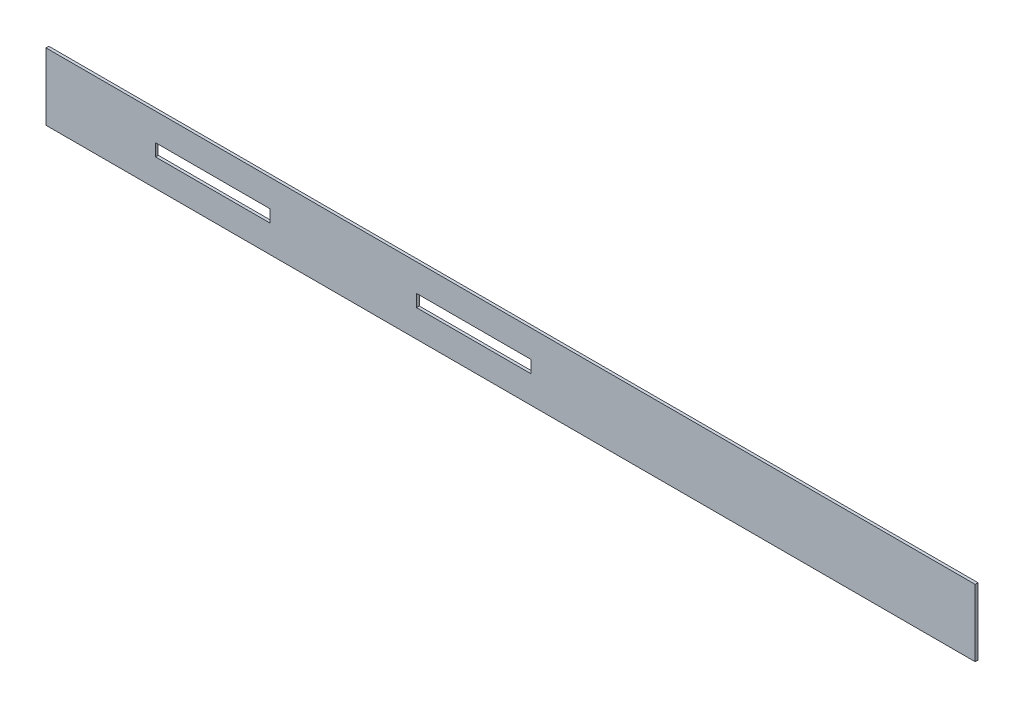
SolidWorks part; units mm, degrees
ref_plane "Plan de face" through (0, 0, 0) normal (0, 0, 1) x (1, 0, 0)
ref_plane "Plan de dessus" through (0, 0, 0) normal (0, 1, 0) x (1, 0, 0)
ref_plane "Plan de droite" through (0, 0, 0) normal (1, 0, 0) x (0, 0, -1)
sketch "Esquisse1" plane through (0, 0, 0) normal (0, 0, 1) x (1, 0, 0)
  line L1 (-1417.1046, 404.5346) -> (1215.8954, 404.5346)
  line L2 (-1417.1046, 404.5346) -> (-1417.1046, 214.5346)
  line L3 (-1417.1046, 214.5346) -> (1215.8954, 214.5346)
  line L4 (1215.8954, 404.5346) -> (1215.8954, 214.5346)
  line L10 (-1417.1046, 209.5346) -> (-1417.1046, 264.5346) construction
  line L11 (1215.8954, 209.5346) -> (-1417.1046, 209.5346) construction
  line L12 (1215.8954, 409.5346) -> (-1417.1046, 409.5346) construction
  line L13 (1215.8954, 209.5346) -> (1215.8954, 264.5346) construction
  dimension "D1" = 5
  dimension "D2" = 5
extrude "Boss.-Extru.1" add sketch "Esquisse1" along normal blind 8
sketch "Esquisse2" plane through (0, 0, 8) normal (0, 0, 1) x (1, 0, 0)
  line L0 (-782.1046, 354.5346) -> (-782.1046, 264.5346) construction
  line L1 (-782.1046, 327.0346) -> (-1107.1046, 327.0346)
  line L2 (-782.1046, 327.0346) -> (-782.1046, 292.0346)
  line L3 (-782.1046, 292.0346) -> (-1107.1046, 292.0346)
  line L4 (-1107.1046, 327.0346) -> (-1107.1046, 292.0346)
  line L5 (-1107.1046, 354.5346) -> (-1107.1046, 264.5346) construction
  line L6 (-782.1046, 309.5346) -> (-1107.1046, 309.5346) construction
  line L7 (-42.1046, 354.5346) -> (-42.1046, 264.5346) construction
  line L8 (-42.1046, 292.0346) -> (-367.1046, 292.0346)
  line L9 (-42.1046, 292.0346) -> (-42.1046, 327.0346)
  line L10 (-42.1046, 327.0346) -> (-367.1046, 327.0346)
  line L11 (-367.1046, 292.0346) -> (-367.1046, 327.0346)
  line L12 (-367.1046, 354.5346) -> (-367.1046, 264.5346) construction
  dimension "D1" = 35
extrude "Enlèv. mat.-Extru.1" cut sketch "Esquisse2" against normal through all
